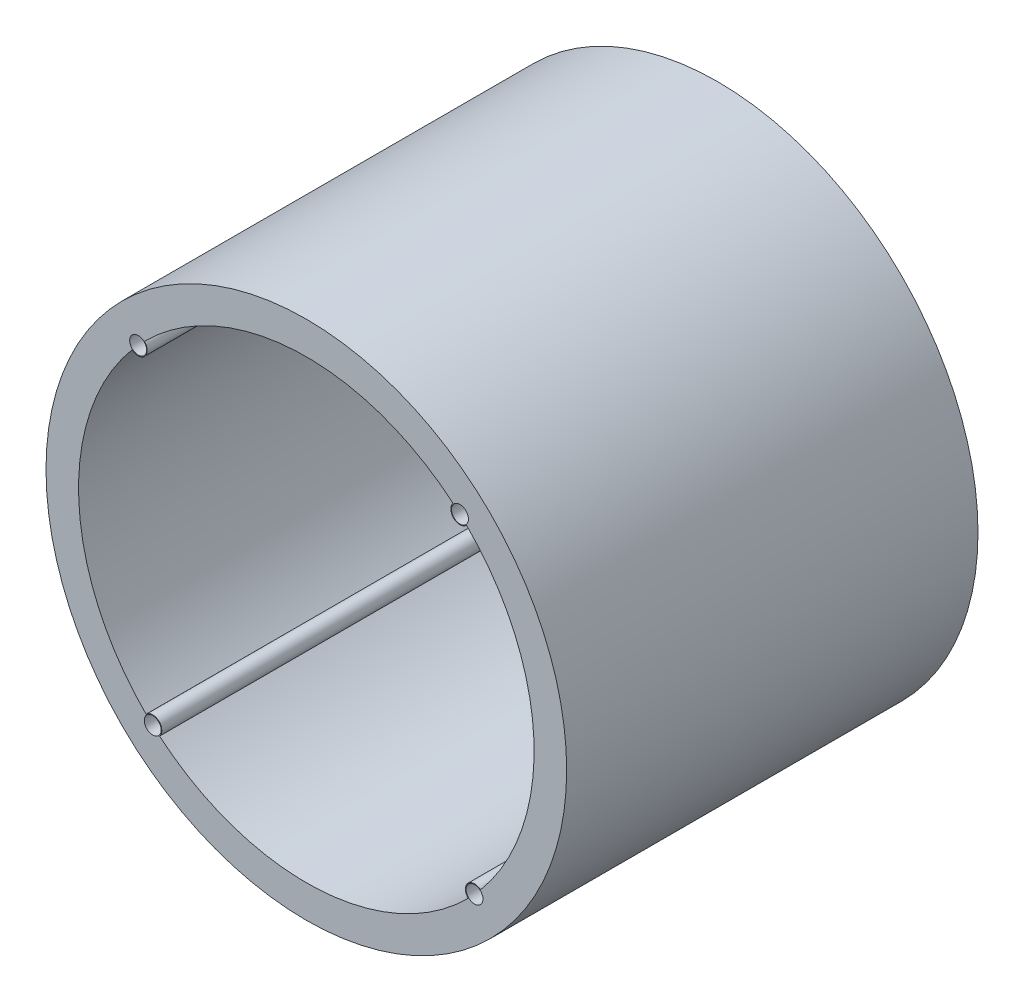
SolidWorks part; units mm, degrees
ref_plane "Front Plane" through (0, 0, 0) normal (0, 0, 1) x (1, 0, 0)
ref_plane "Top Plane" through (0, 0, 0) normal (0, 1, 0) x (1, 0, 0)
ref_plane "Right Plane" through (0, 0, 0) normal (1, 0, 0) x (0, 0, -1)
sketch "Sketch1" plane through (0, 0, 0) normal (0, 0, 1) x (1, 0, 0)
  circle A0 centre (0, 0) radius 50.8
  dimension "D1" = 101.6
extrude "Boss-Extrude3" add sketch "Sketch1" along normal blind 80.264 contours A0
sketch "Sketch6" plane through (0, 0, 80.264) normal (0, 0, 1) x (1, 0, 0)
  circle A0 centre (0, 0) radius 44.45
  dimension "D1" = 88.9
extrude "Cut-Extrude2" cut sketch "Sketch6" against normal blind 80.264 contours A0
sketch "Sketch7" plane through (0, 0, 80.264) normal (0, 0, 1) x (1, 0, 0)
  line L0 (0, 0) -> (44.4146, 1.7733)
  line L1 (44.4146, 1.7733) -> (0, 0)
  line L2 (0, 0) -> (29.9785, 32.8191)
  circle A0 centre (0, 0) radius 44.45 construction
  circle A1 centre (29.9785, 32.8191) radius 1.778
  dimension "D1" = 3.556
extrude "Boss-Extrude9" add sketch "Sketch7" against normal blind 80.264 contours A1
sketch "Sketch12" plane through (0, 0, 80.264) normal (0, 0, 1) x (1, 0, 0)
  line L0 (0, 0) -> (29.9785, 32.8191)
  line L1 (29.9785, 32.8191) -> (0, 0)
  line L2 (0, 0) -> (-29.9785, -32.8191)
  arc A0 (28.642, 33.9918) -> (31.267, 31.594) centre (0, 0) ccw construction
  circle A1 centre (-29.9785, -32.8191) radius 1.778
  dimension "D1" = 3.556
extrude "Boss-Extrude10" add sketch "Sketch12" against normal blind 80.264 contours A1
sketch "Sketch13" plane through (0, 0, 80.264) normal (0, 0, 1) x (1, 0, 0)
  line L0 (0, 0) -> (29.9785, 32.8191)
  line L1 (29.9785, 32.8191) -> (0, 0)
  line L2 (0, 0) -> (-32.8191, 29.9785)
  arc A0 (28.642, 33.9918) -> (-31.267, -31.594) centre (0, 0) ccw construction
  circle A1 centre (-32.8191, 29.9785) radius 1.778
  dimension "D1" = 3.556
extrude "Boss-Extrude11" add sketch "Sketch13" against normal blind 80.264 contours A1
sketch "Sketch14" plane through (0, 0, 80.264) normal (0, 0, 1) x (1, 0, 0)
  line L0 (0, 0) -> (29.9785, 32.8191)
  line L1 (29.9785, 32.8191) -> (0, 0)
  line L2 (0, 0) -> (32.8191, -29.9785)
  line L3 (32.8191, -29.9785) -> (0, 0)
  arc A0 (-28.642, -33.9918) -> (31.267, 31.594) centre (0, 0) ccw construction
  circle A1 centre (32.8191, -29.9785) radius 1.778
  dimension "D1" = 3.556
extrude "Boss-Extrude12" add sketch "Sketch14" against normal blind 80.264 contours A1
sketch "Sketch15" plane through (0, 0, 80.264) normal (0, 0, 1) x (1, 0, 0)
  line L0 (0, 0) -> (29.9785, 32.8191)
  line L1 (29.9785, 32.8191) -> (0, 0)
  circle A0 centre (29.9785, 32.8191) radius 1.651
  dimension "D1" = 3.302
extrude "Cut-Extrude5" cut sketch "Sketch15" against normal blind 80.264 contours A0
sketch "Sketch16" plane through (0, 0, 80.264) normal (0, 0, 1) x (1, 0, 0)
  line L0 (0, 0) -> (-32.8191, 29.9785)
  circle A0 centre (-32.8191, 29.9785) radius 1.651
  dimension "D1" = 3.302
extrude "Cut-Extrude6" cut sketch "Sketch16" against normal blind 80.264 contours A0
sketch "Sketch17" plane through (0, 0, 80.264) normal (0, 0, 1) x (1, 0, 0)
  line L0 (0, 0) -> (-29.9785, -32.8191)
  circle A0 centre (-29.9785, -32.8191) radius 1.651
  dimension "D1" = 3.302
extrude "Cut-Extrude7" cut sketch "Sketch17" against normal blind 80.264 contours A0
sketch "Sketch18" plane through (0, 0, 80.264) normal (0, 0, 1) x (1, 0, 0)
  line L0 (0, 0) -> (32.8191, -29.9785)
  circle A0 centre (32.8191, -29.9785) radius 1.651
  dimension "D1" = 3.302
extrude "Cut-Extrude8" cut sketch "Sketch18" against normal blind 80.264 contours A0
